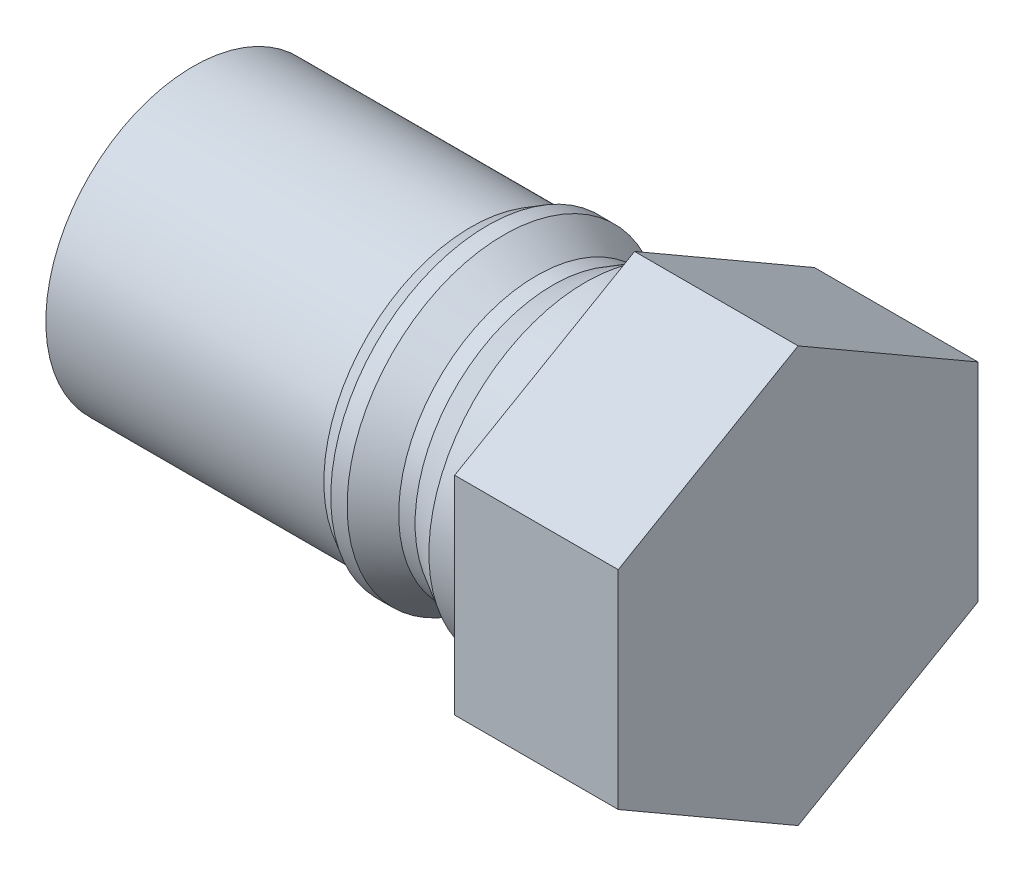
SolidWorks part; units mm, degrees
ref_plane "Alzado" through (0, 0, 0) normal (0, 0, 1) x (1, 0, 0)
ref_plane "Planta" through (0, 0, 0) normal (0, 1, 0) x (1, 0, 0)
ref_plane "Vista lateral" through (0, 0, 0) normal (1, 0, 0) x (0, 0, -1)
sketch "Croquis1" plane through (0, 0, 0) normal (0, 0, 1) x (1, 0, 0)
  line L0 (0, 0) -> (27, 0) construction
  line L1 (0, 0) -> (0, 9)
  line L2 (0, 9) -> (17, 9)
  line L3 (17, 9) -> (18, 9.5774)
  line L4 (18, 9.5774) -> (19, 9.5774)
  line L5 (18.5, 9.5774) -> (18.5, 0) construction
  line L6 (20, 9) -> (19, 9.5774)
  line L7 (20, 9) -> (21, 8.4226)
  line L8 (21, 8.4226) -> (22, 8.4226)
  line L9 (21.5, 8.4226) -> (21.5, 0) construction
  line L10 (23, 9) -> (22, 8.4226)
  line L11 (23, 9) -> (24, 9.5774)
  line L12 (24, 9.5774) -> (27, 9.5774)
  line L13 (27, 9.5774) -> (27, 0)
  line L14 (27, 0) -> (0, 0)
  dimension "D1" = 18
  dimension "D2" = 17
  dimension "D3" = 1
  dimension "D4" = 1
  dimension "D5" = 150
  dimension "D6" = 1
  dimension "D7" = 1
  dimension "D8" = 3
revolve "Revolución1" add sketch "Croquis1" angle 360 about L14
sketch "Croquis4" plane through (27, 0, 0) normal (1, 0, 0) x (0, 0, -1)
  line L1 (0, 12.7017) -> (-11, 6.3509)
  line L2 (-11, 6.3509) -> (-11, -6.3509)
  line L3 (-11, -6.3509) -> (0, -12.7017)
  line L4 (0, -12.7017) -> (11, -6.3509)
  line L5 (11, -6.3509) -> (11, 6.3509)
  line L6 (11, 6.3509) -> (0, 12.7017)
  circle A0 centre (0, 0) radius 11 construction
  dimension "D1" = 22
extrude "Saliente-Extruir3" add sketch "Croquis4" along normal blind 10
